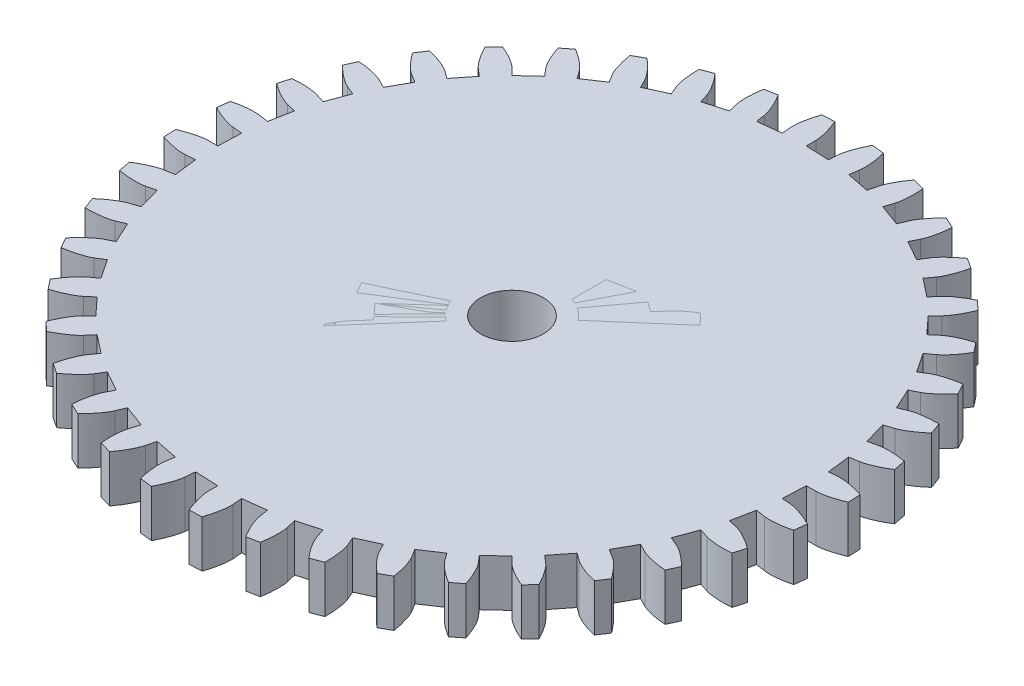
SolidWorks part; units mm, degrees
ref_plane "Front Plane" through (0, 0, 0) normal (0, 0, 1) x (1, 0, 0)
ref_plane "Top Plane" through (0, 0, 0) normal (0, 1, 0) x (1, 0, 0)
ref_plane "Right Plane" through (0, 0, 0) normal (1, 0, 0) x (0, 0, -1)
sketch "Sketch1" plane through (0, 0, 0) normal (0, 1, 0) x (1, 0, 0)
  line L0 (0, 0) -> (0, 9.6815) construction
  line L1 (0, 0) -> (-9.6815, 0) construction
  line L2 (0, 0) -> (-10.4919, -0.4122) construction
  line L3 (0, 0) -> (-9.6516, -0.7596) construction
  line L4 (0, 0) -> (-9.5623, -1.5145) construction
  circle A0 centre (0, 0) radius 10 construction
  circle A1 centre (0, 0) radius 9.6815 construction
  circle A2 centre (0, 0) radius 9.375 construction
  circle A3 centre (0, 0) radius 10.5 construction
  spline S0 degree 4 poles (-9.6815, 0) (-9.6978, 0) (-9.7436, -0.0017) (-9.8299, -0.0115) (-9.9693, -0.0368) (-10.1443, -0.0827) (-10.3662, -0.1574) (-10.6212, -0.2646) (-10.8931, -0.4023) (-11.1787, -0.5725) (-11.4536, -0.7601) (-11.7175, -0.9628) (-11.9704, -1.1789) (-12.2643, -1.4557) (-12.5986, -1.8099) (-12.9609, -2.2506) (-13.3365, -2.7854) (-13.6788, -3.3564) (-13.9817, -3.949) (-14.2463, -4.56) (-14.4449, -5.1071) (-14.5924, -5.5844) (-14.722, -6.0652) (-14.8153, -6.4724) (-14.894, -6.8773) (-14.9588, -7.293) (-15.0019, -7.6142) (-15.0376, -7.9608) (-15.0636, -8.264) (-15.0877, -8.7119) (-15.0947, -8.9809) (-15.0984, -9.4109) (-15.0902, -9.6182) (-15.0869, -9.7968) (-15.0834, -9.845) (-15.0821, -9.8846) knots 0 0 0 0 0 0.005377 0.015084 0.028532 0.04661 0.064855 0.092111 0.119476 0.146842 0.174209 0.201575 0.228941 0.256307 0.307035 0.361767 0.4165 0.471232 0.525964 0.580697 0.635429 0.662795 0.690161 0.744894 0.77226 0.799626 0.826992 0.854358 0.881725 0.909091 0.954545 0.977273 0.988636 1 1 1 1 1 construction
  spline S1 degree 4 poles (-9.6815, 0) (-9.6978, 0) (-9.7436, -0.0017) (-9.8299, -0.0115) (-9.9693, -0.0368) (-10.1443, -0.0827) (-10.3662, -0.1574) (-10.6212, -0.2646) (-10.8931, -0.4023) (-11.1787, -0.5725) (-11.4536, -0.7601) (-11.7175, -0.9628) (-11.9704, -1.1789) (-12.2643, -1.4557) (-12.5986, -1.8099) (-12.9609, -2.2506) (-13.3365, -2.7854) (-13.6788, -3.3564) (-13.9817, -3.949) (-14.2463, -4.56) (-14.4449, -5.1071) (-14.5924, -5.5844) (-14.722, -6.0652) (-14.8153, -6.4724) (-14.894, -6.8773) (-14.9588, -7.293) (-15.0019, -7.6142) (-15.0376, -7.9608) (-15.0636, -8.264) (-15.0791, -8.5523) (-15.0855, -8.7049) (-15.088, -8.7805) knots 0 0 0 0 0 0.005377 0.015084 0.028532 0.04661 0.064855 0.092111 0.119476 0.146842 0.174209 0.201575 0.228941 0.256307 0.307035 0.361767 0.4165 0.471232 0.525964 0.580697 0.635429 0.662795 0.690161 0.744894 0.77226 0.799626 0.826992 0.854358 0.881725 0.909091 0.909091 0.909091 0.909091 0.909091
  dimension "D1" = 21
  dimension "D2" = 20
  dimension "D3" = 19.363
  dimension "D4" = 18.75
  dimension "D5" = 9.6815
  dimension "D6" = 2.25
  dimension "D7" = 4.5
  dimension "D8" = 9
sketch "Sketch2" plane through (0, 0, 0) normal (0, 1, 0) x (1, 0, 0)
  line L0 (0, 0) -> (-10.4919, -0.4122) construction
  line L1 (0, 0) -> (-10.4919, -0.4122) construction
  line L2 (0, 0) -> (-9.6516, -0.7596) construction
  line L3 (0, 0) -> (-9.6815, 0) construction
  line L4 (0, 0) -> (-9.5623, -1.5145) construction
  line L5 (0, 0) -> (-9.6516, -0.7596) construction
  line L6 (0, 0) -> (-9.6815, 0) construction
  line L7 (0, 0) -> (-9.5623, -1.5145) construction
  line L8 (-9.6516, -0.7596) -> (-9.3461, -0.7356)
  line L9 (-9.3461, -0.7356) -> (-9.2596, -1.4666)
  line L10 (-9.2596, -1.4666) -> (-9.5623, -1.5145) construction
  line L11 (-9.2596, -1.4666) -> (-0.9877, -0.1564)
  line L12 (-9.6815, 0) -> (-1, 0)
  circle A0 centre (0, 0) radius 9.375 construction
  circle A1 centre (0, 0) radius 9.6815 construction
  circle A2 centre (0, 0) radius 10 construction
  circle A3 centre (0, 0) radius 10.5 construction
  circle A4 centre (0, 0) radius 9.375 construction
  circle A5 centre (0, 0) radius 9.6815 construction
  circle A6 centre (0, 0) radius 10 construction
  circle A7 centre (0, 0) radius 10.5 construction
  arc A8 (-10.4823, -0.6097) -> (-10.4978, -0.2146) centre (0, 0) cw
  circle A11 centre (0, 0) radius 1 construction
  arc A12 (-1, 0) -> (-0.9877, -0.1564) centre (0, 0) ccw
  spline S0 degree 4 poles (-71.299, -1998.9199) (-6.8473, -37.9907) (-7.2578, -0.7705) (-8.6829, 0.1971) (-9.9693, -0.0368) (-10.1443, -0.0827) (-10.3662, -0.1574) (-10.6212, -0.2646) (-10.8931, -0.4023) (-11.1787, -0.5725) (-11.4536, -0.7601) (-11.7175, -0.9628) (-11.9704, -1.1789) (-12.2643, -1.4557) (-12.5986, -1.8099) (-12.9609, -2.2506) (-13.3365, -2.7854) (-13.6788, -3.3564) (-13.9817, -3.949) (-14.2463, -4.56) (-14.4449, -5.1071) (-14.5924, -5.5844) (-14.722, -6.0652) (-14.8153, -6.4724) (-14.894, -6.8773) (-14.9588, -7.293) (-15.0019, -7.6142) (-15.0376, -7.9608) (-15.18, -9.6199) (-15.1217, -14.1555) (-12.75, 44.3663) (-80.4182, -2007.5727) knots -0.383502 -0.383502 -0.383502 -0.383502 -0.383502 0.005377 0.015084 0.028532 0.04661 0.064855 0.092111 0.119476 0.146842 0.174209 0.201575 0.228941 0.256307 0.307035 0.361767 0.4165 0.471232 0.525964 0.580697 0.635429 0.662795 0.690161 0.744894 0.77226 0.799626 0.826992 0.854358 0.881725 1.398587 1.398587 1.398587 1.398587 1.398587 only from (-9.6815, 0) to (-15.088, -8.7805) construction
  spline S1 degree 4 poles (-9.6815, 0) (-9.6978, 0) (-9.7436, -0.0017) (-9.8299, -0.0115) (-9.9693, -0.0368) (-10.1443, -0.0827) (-10.302, -0.1358) (-10.4189, -0.1814) (-10.4839, -0.2087) (-10.4978, -0.2146) knots 0 0 0 0 0 0.005377 0.015084 0.028532 0.04661 0.064855 0.06982 0.06982 0.06982 0.06982 0.06982
  spline S2 degree 4 poles (-9.6516, -0.7596) (-9.6679, -0.7609) (-9.7137, -0.7628) (-9.8005, -0.7598) (-9.9414, -0.7455) (-10.1195, -0.7134) (-10.2809, -0.6729) (-10.401, -0.6366) (-10.468, -0.6145) (-10.4823, -0.6097) knots 0 0 0 0 0 0.005377 0.015084 0.028532 0.04661 0.064855 0.06982 0.06982 0.06982 0.06982 0.06982
  point P21 (-9.3461, -0.7356)
  point P24 (-9.2596, -1.4666)
  dimension "D2" = 2
extrude "Boss-Extrude1" add sketch "Sketch2" along normal blind 1.5
pattern_circular "CirPattern1" count 40 over 360 of "Boss-Extrude1"
equation "\"Module\"= .5"
equation "\"Number of Teeth\"= 40"
equation "\"Pressure Angle\"= 14.5deg"
equation "\"Pitch Diameter\"= \"Number of Teeth\" * \"Module\""
equation "\"Circular Pitch\"= pi * \"Module\""
equation "\"Addendum\"= \"Module\""
equation "\"Dedendum\"= 1.25 * \"Module\""
equation "\"Base Diameter\"= \"Pitch Diameter\" * cos ( \"Pressure Angle\" )"
equation "\"Base Radius\"= \"Base Diameter\" / 2"
equation "\"Width\"= 1.5"
equation "\"Outside Diameter\"= \"Pitch Diameter\" + 2 * \"Addendum\""
equation "\"D1@Sketch1\"=\"Outside Diameter\""
equation "\"D3@Sketch1\"=\"Base Diameter\""
equation "\"Root Diameter\"= \"Pitch Diameter\" - 2 * \"Dedendum\""
equation "\"D4@Sketch1\"=\"Root Diameter\""
equation "\"Tooth Angle\"= 360 / \"Number of Teeth\""
equation "\"D6@Sketch1\"=\"Tooth Angle\"/4"
equation "\"D7@Sketch1\"=\"Tooth Angle\"/2"
equation "\"D8@Sketch1\"=\"Tooth Angle\""
equation "\"D2@Sketch1\" = \"Pitch Diameter\""
equation "\"Shaft Diameter\" = 2"
equation "\"D1@CirPattern1\" = \"Number of Teeth\""
equation "\"D2@Sketch2\"= \"Shaft Diameter\""
equation "\"D1@Boss-Extrude1\" = \"Width\""
